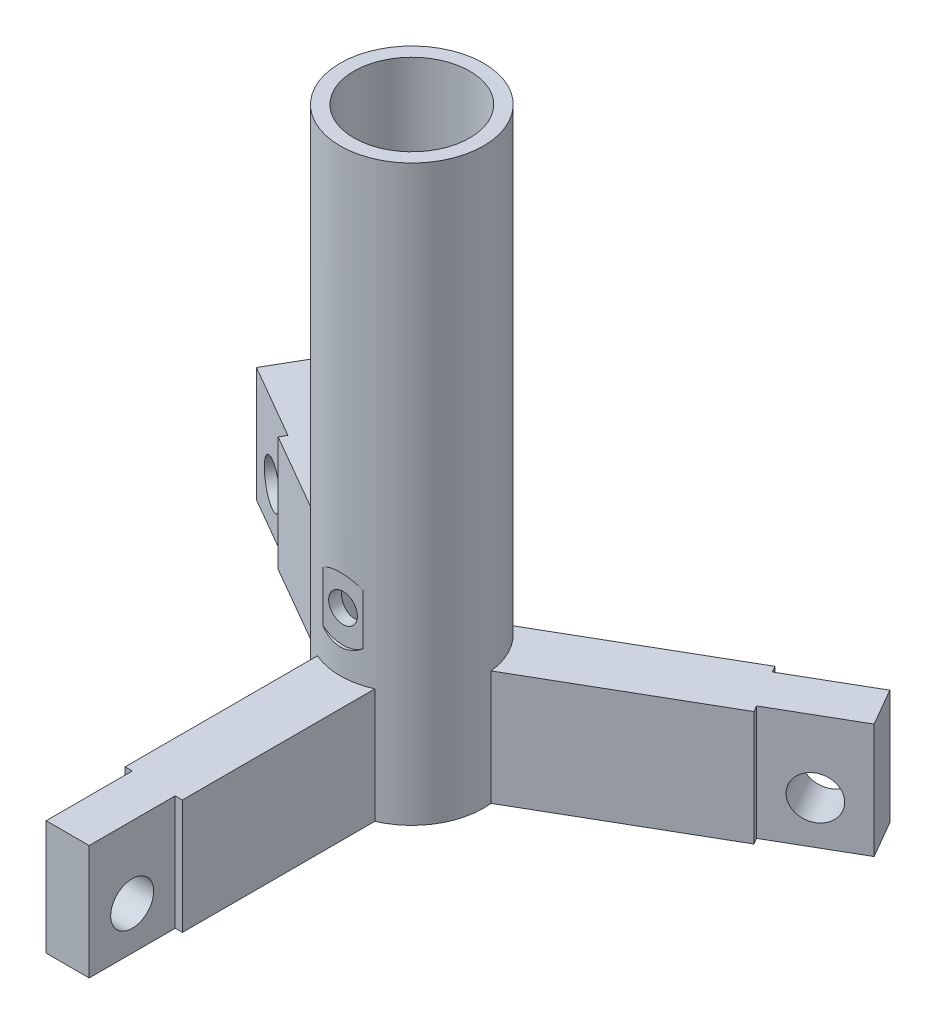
SolidWorks part; units mm, degrees
ref_plane "Plane1" through (0, 0, 0) normal (0, 0, 1) x (1, 0, 0)
ref_plane "Plane2" through (0, 0, 0) normal (0, 1, 0) x (1, 0, 0)
ref_plane "Plane3" through (0, 0, 0) normal (1, 0, 0) x (0, 0, -1)
sketch "Sketch1" plane through (0, 0, 0) normal (0, 1, 0) x (1, 0, 0)
  circle A0 centre (0, 0) radius 12.827
  circle A1 centre (0, 0) radius 15.875
  dimension "D1" = 25.654
  dimension "D2" = 31.75
extrude "Base-Extrude" add sketch "Sketch1" along normal blind 127
ref_plane "Plane4" through (0, 0, 76.2) normal (0, 0, 1) x (-1, 0, 0)
ref_plane "Plane5" through (0, 0, 57.15) normal (0, 0, 1) x (-1, 0, 0)
sketch "Sketch2" plane through (0, 0, 76.2) normal (0, 0, 1) x (-1, 0, 0)
  line L0 (0, 0) -> (0, 23.9235) construction
  line L1 (-4.7625, 0) -> (4.7625, 0)
  line L2 (15.875, 0) -> (-15.875, 0) construction
  line L3 (4.7625, 0) -> (4.7625, -25.4)
  line L4 (-4.7625, 0) -> (-4.7625, -25.4)
  line L5 (4.7625, -25.4) -> (-4.7625, -25.4)
  point P7 (0, 0)
  point P11 (0, -25.4)
  dimension "D1" = 25.4
  dimension "D2" = 9.525
extrude "Boss-Extrude1" add sketch "Sketch2" along normal up to surface (61.0562 mm away)
sketch "Sketch3" plane through (4.7625, 0, 0) normal (1, 0, 0) x (0, 0, -1)
  line L0 (-76.2, 0) -> (-76.2, 25.4) construction
  line L1 (-15.1438, 0) -> (-76.2, 0) construction
  circle A0 centre (-66.675, 9.525) radius 4.7625
  dimension "D1" = 9.525
  dimension "D2" = 9.525
  dimension "D3" = 9.525
extrude "Cut-Extrude1" cut sketch "Sketch3" against normal through all
sketch "Sketch13" plane through (0, 0, 57.15) normal (0, 0, 1) x (-1, 0, 0)
  line L0 (0, 25.4) -> (0, -5.2456) construction
  line L1 (4.7625, -25.4) -> (-4.7625, -25.4) construction
  line L2 (6.35, -25.4) -> (-6.35, -25.4)
  line L3 (-6.35, -25.4) -> (-6.35, 0)
  line L4 (6.35, -25.4) -> (6.35, 0)
  line L5 (-6.35, 0) -> (6.35, 0)
  point P8 (0, -25.4)
  point P9 (0, -25.4)
  point P12 (0, 0)
  dimension "D1" = 12.7
extrude "Boss-Extrude2" add sketch "Sketch13" along normal up to surface
pattern_circular "CirPattern1" count 3 every 120 about axis through (0, 0, 0) along (0, 1, 0) of "Boss-Extrude1", "Cut-Extrude1", "Boss-Extrude2"
ref_plane "Plane6" through (0, 0, 15.875) normal (0, 0, 1) x (-1, 0, 0)
sketch "Sketch10" plane through (0, 0, 15.875) normal (0, 0, 1) x (-1, 0, 0)
  line L0 (0, 0) -> (0, 58.2673) construction
  line L2 (12.827, 0) -> (-12.827, 0) construction
  circle A0 centre (0, -38.1) radius 7.1501
  dimension "D1" = 14.3002
  dimension "D2" = 38.1
extrude "Cut-Extrude2" cut sketch "Sketch10" against normal blind 0.635
hole_wizard "Hole1" positions "Sketch11" profile "Sketch12" legacy
sketch "Sketch11" plane through (0, 0, 15.24) normal (0, 0, 1) x (-1, 0, 0)
  point P0 (0, -38.1)
sketch "Sketch12" plane through (0, 38.1, 15.24) normal (1, 0, 0) x (0, -1, 0)
  line L0 (0, 0) -> (0, 14.2338)
  line L1 (0, 14.2338) -> (2.5527, 12.7)
  line L2 (2.5527, 12.7) -> (2.5527, 9.525)
  line L3 (2.5527, 9.525) -> (3.175, 9.525)
  line L4 (3.175, 9.525) -> (3.175, 0.0025)
  line L5 (3.175, 0.0025) -> (3.175, 0)
  line L6 (3.175, 0) -> (0, 0)
